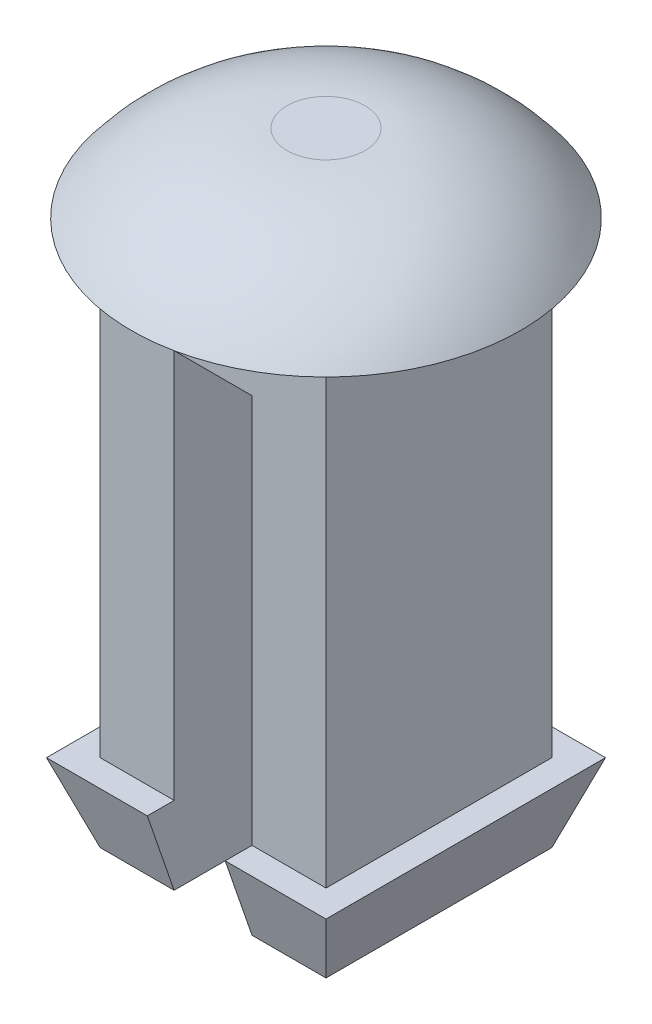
SolidWorks part; units mm, degrees
ref_plane "Front Plane" through (0, 0, 0) normal (0, 0, 1) x (1, 0, 0)
ref_plane "Top Plane" through (0, 0, 0) normal (0, 1, 0) x (1, 0, 0)
ref_plane "Right Plane" through (0, 0, 0) normal (1, 0, 0) x (0, 0, -1)
sketch "Sketch1" plane through (0, 0, 0) normal (0, 1, 0) x (1, 0, 0)
  line L1 (3.683, -3.683) -> (-3.683, -3.683)
  line L2 (3.683, -3.683) -> (3.683, 3.683)
  line L3 (3.683, 3.683) -> (-3.683, 3.683)
  line L4 (-3.683, -3.683) -> (-3.683, 3.683)
  line L5 (3.683, -3.683) -> (-3.683, 3.683) construction
  line L6 (3.683, 3.683) -> (-3.683, -3.683) construction
  point P0 (0, 0)
  dimension "D1" = 7.366
extrude "Boss-Extrude1" add sketch "Sketch1" along normal blind 17.78
sketch "Sketch2" plane through (0, 0, 0) normal (0, -1, 0) x (1, 0, 0)
  line L0 (3.683, -3.683) -> (-3.683, -3.683) construction
  line L1 (3.683, 3.683) -> (1.143, 3.683)
  line L2 (3.683, 3.683) -> (3.683, -3.683)
  line L3 (3.683, -3.683) -> (1.143, -3.683)
  line L4 (1.143, 3.683) -> (1.143, -3.683)
  line L5 (-3.683, 3.683) -> (3.683, 3.683) construction
  line L6 (-1.143, 3.683) -> (-3.683, 3.683)
  line L7 (-1.143, 3.683) -> (-1.143, -3.683)
  line L8 (-1.143, -3.683) -> (-3.683, -3.683)
  line L9 (-3.683, 3.683) -> (-3.683, -3.683)
  dimension "D1" = 2.54
extrude "Boss-Extrude2" add sketch "Sketch2" against normal blind 2.54 draft 19
sketch "Sketch3" plane through (0, 0, 0) normal (0, -1, 0) x (1, 0, 0)
  line L1 (-1.27, 8.1828) -> (1.27, 8.1828)
  line L2 (-1.27, 8.1828) -> (-1.27, -8.1828)
  line L3 (-1.27, -8.1828) -> (1.27, -8.1828)
  line L4 (1.27, 8.1828) -> (1.27, -8.1828)
  point P4 (0, -8.1828)
  point P8 (-1.27, 0)
  dimension "D1" = 2.54
extrude "Cut-Extrude1" cut sketch "Sketch3" against normal offset from surface (15.24 mm away) 2.54
sketch "Sketch4" plane through (0, 0, 0) normal (0, 0, 1) x (1, 0, 0)
  line L0 (0, 0) -> (0, 19.0719) construction
  line L4 (0, 17.78) -> (0, 20.32)
  line L5 (0, 20.32) -> (1.27, 20.32)
  line L6 (0, 17.78) -> (6.35, 17.78)
  arc A1 (1.27, 20.32) -> (6.35, 17.78) centre (1.27, 13.97) cw
  dimension "D2" = 6.35
  dimension "D1" = 6.35
  dimension "D4" = 1.27
revolve "Revolve1" add sketch "Sketch4" angle 360 about L0
